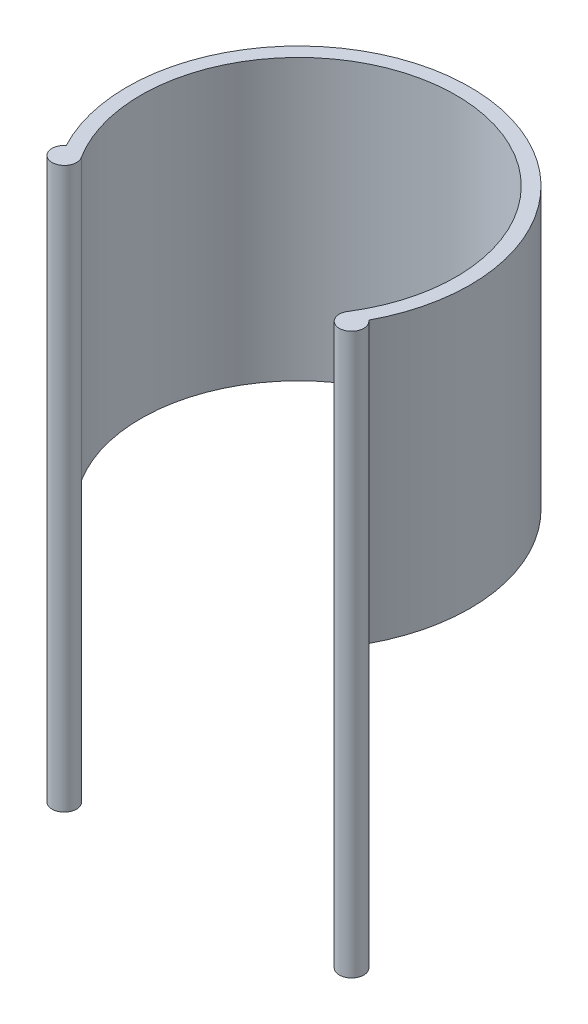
SolidWorks part; units mm, degrees
ref_plane "Front Plane" through (0, 0, 0) normal (0, 0, 1) x (1, 0, 0)
ref_plane "Top Plane" through (0, 0, 0) normal (0, 1, 0) x (1, 0, 0)
ref_plane "Right Plane" through (0, 0, 0) normal (1, 0, 0) x (0, 0, -1)
sketch "Sketch1" plane through (0, 0, 0) normal (0, 1, 0) x (1, 0, 0)
  line L0 (-19.0329, -12) -> (19.0329, -12) construction
  line L1 (0, 0) -> (0, -12) construction
  arc A0 (19.0329, -12) -> (-19.0329, -12) centre (0, 0) ccw
  arc A1 (-19.0329, -12) -> (-21.9922, -12) centre (-20.5125, -12.9329) cw
  arc A2 (19.0329, -12) -> (21.9922, -12) centre (20.5125, -12.9329) ccw
  dimension "D1" = 45
  dimension "D3" = 1.7492
  dimension "D2" = 12
extrude "Extrude-Thin1" add sketch "Sketch1" along normal blind 40 thin
sketch "Sketch2" plane through (0, 40, 0) normal (0, 1, 0) x (1, 0, 0)
  circle A0 centre (-20.5125, -12.9329) radius 1.75
  circle A1 centre (20.5125, -12.9329) radius 1.75
  dimension "D1" = 3.5
extrude "Boss-Extrude1" add sketch "Sketch2" against normal blind 80
